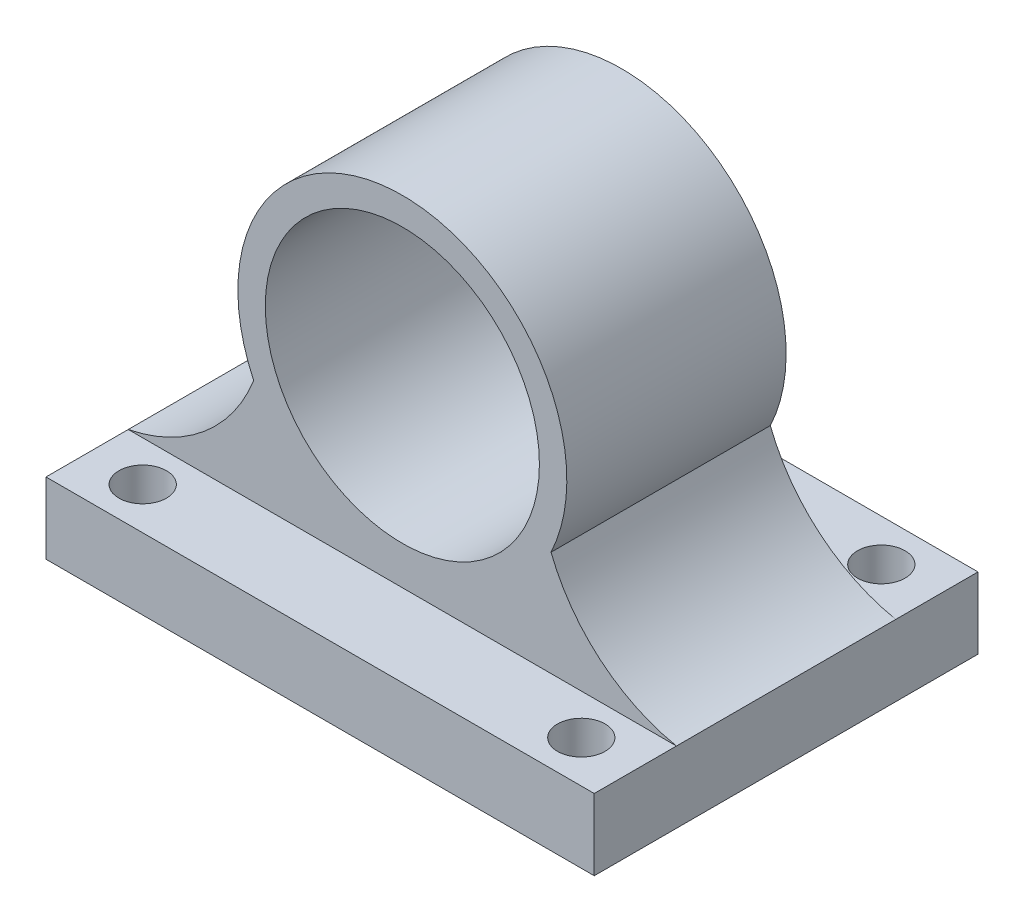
SolidWorks part; units mm, degrees
ref_plane "Front Plane" through (0, 0, 0) normal (0, 0, 1) x (1, 0, 0)
ref_plane "Top Plane" through (0, 0, 0) normal (0, 1, 0) x (1, 0, 0)
ref_plane "Right Plane" through (0, 0, 0) normal (1, 0, 0) x (0, 0, -1)
sketch "Sketch1" plane through (0, 0, 0) normal (0, 1, 0) x (1, 0, 0)
  line L1 (-31.75, -22.225) -> (31.75, -22.225)
  line L2 (-31.75, -22.225) -> (-31.75, 22.225)
  line L3 (-31.75, 22.225) -> (31.75, 22.225)
  line L4 (31.75, -22.225) -> (31.75, 22.225)
  line L5 (-31.75, -22.225) -> (31.75, 22.225) construction
  line L6 (-31.75, 22.225) -> (31.75, -22.225) construction
  point P0 (0, 0)
  dimension "D1" = 44.45
  dimension "D2" = 63.5
extrude "Extrude1" add sketch "Sketch1" along normal blind 8.255
sketch "Sketch2" plane through (0, 8.255, 0) normal (0, 1, 0) x (-1, 0, 0)
  line L0 (31.75, 12.7) -> (-31.75, 12.7)
  line L1 (31.75, -22.225) -> (31.75, 22.225) construction
  line L2 (-31.75, 22.225) -> (-31.75, -22.225) construction
  line L3 (31.75, 22.225) -> (-31.75, 22.225) construction
  dimension "D1" = 9.525
ref_plane "Plane1" through (0, 0, 12.7) normal (0, 0, 1) x (1, 0, 0)
sketch "Sketch4" plane through (0, 0, 12.7) normal (0, 0, 1) x (1, 0, 0)
  line L0 (-31.75, 8.255) -> (31.75, 8.255) construction
  line L1 (-31.75, 8.255) -> (31.75, 8.255)
  line L2 (0, 12.7) -> (0, 44.45) construction
  line L3 (0, 44.45) -> (0, 53.975)
  line L4 (12.7, 53.975) -> (-12.7, 53.975)
  line L5 (-12.7, 53.975) -> (-12.7, 42.774)
  line L6 (12.7, 53.975) -> (12.7, 42.774)
  line L8 (-31.75, 0) -> (31.75, 0) construction
  circle A0 centre (0, 28.575) radius 15.875
  arc A1 (17.2205, 20.429) -> (-17.2205, 20.429) centre (0, 28.575) ccw
  circle A2 centre (0, 28.575) radius 19.05 construction
  arc A3 (-31.75, 8.255) -> (-17.2205, 20.429) centre (-35.6033, 27.6112) ccw
  arc A5 (31.75, 8.255) -> (17.2205, 20.429) centre (35.6033, 27.6112) cw
  point P2 (0, 12.7)
  dimension "D1" = 12.7
  dimension "D2" = 31.75
  dimension "D4" = 9.525
  dimension "D5" = 25.4
  dimension "D3" = 3.175
extrude "Extrude2" add sketch "Sketch4" against normal blind 25.4
sketch "Sketch5" plane through (0, 0, 0) normal (0, -1, 0) x (1, 0, 0)
  line L0 (0, -17.3736) -> (19.05, -17.3736)
  line L1 (0, -17.3736) -> (-19.05, -17.3736)
  line L6 (0, 17.3736) -> (-19.05, 17.3736)
  line L7 (0, 17.3736) -> (19.05, 17.3736)
  line L9 (-25.4, -17.3736) -> (25.4, -17.3736)
  line L10 (-25.4, -17.3736) -> (-25.4, 17.3736)
  line L11 (-25.4, 17.3736) -> (25.4, 17.3736)
  line L12 (25.4, -17.3736) -> (25.4, 17.3736)
  line L13 (-25.4, -17.3736) -> (25.4, 17.3736) construction
  line L14 (-25.4, 17.3736) -> (25.4, -17.3736) construction
  circle A0 centre (-25.4, -17.3736) radius 2.7559
  circle A1 centre (25.4, -17.3736) radius 2.7559
  circle A4 centre (25.4, 17.3736) radius 2.7559
  arc A5 (25.4, -20.1295) -> (25.4, -14.6177) centre (25.4, -17.3736) ccw
  arc A6 (-25.4, -14.6177) -> (-25.4, -20.1295) centre (-25.4, -17.3736) ccw
  circle A7 centre (-25.4, 17.3736) radius 2.7559
  point P25 (0, 0)
  dimension "D10" = 5.5118
  dimension "D8" = 50.8
  dimension "D9" = 34.7472
extrude "Extrude3" cut sketch "Sketch5" against normal blind 25.4 contours A7 | A0 | A4 | A1
